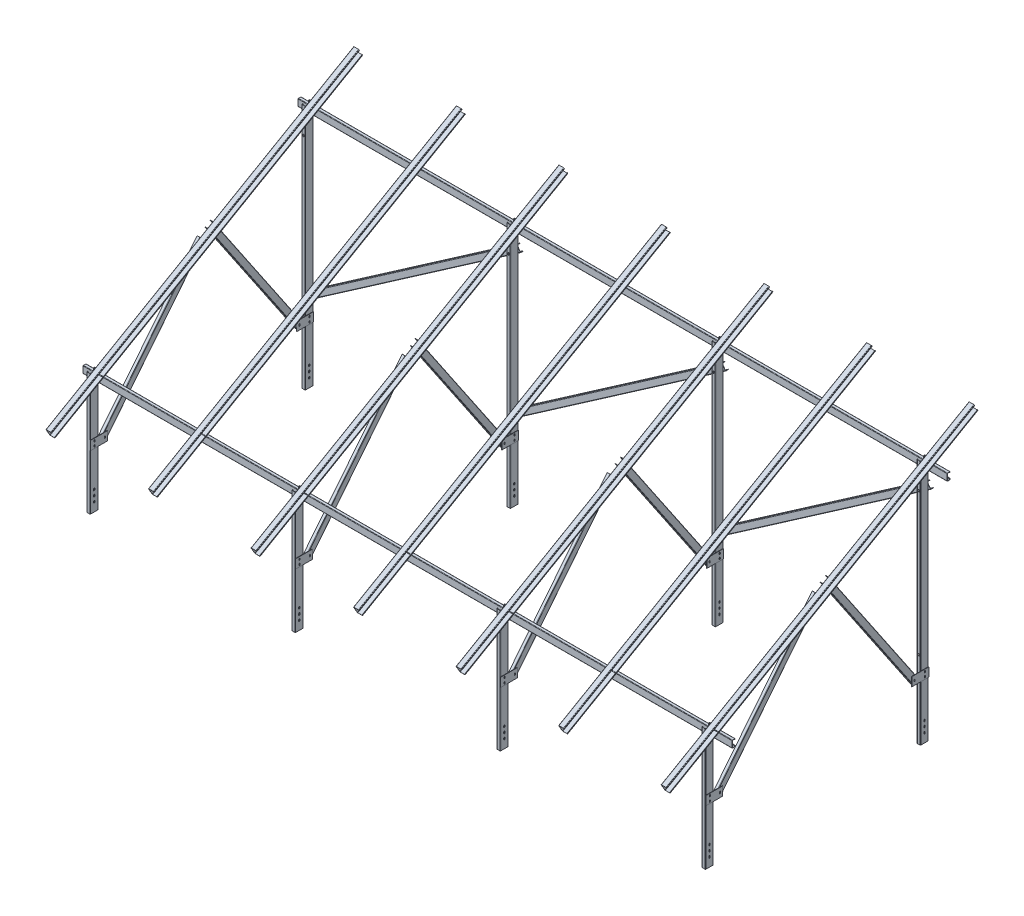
SolidWorks part; units mm, degrees
ref_plane "Front Plane" through (0, 0, 0) normal (0, 0, 1) x (1, 0, 0)
ref_plane "Top Plane" through (0, 0, 0) normal (0, 1, 0) x (1, 0, 0)
ref_plane "Right Plane" through (0, 0, 0) normal (1, 0, 0) x (0, 0, -1)
sketch "Sketch1" plane through (0, 0, 0) normal (1, 0, 0) x (0, 0, -1)
  line L0 (0, 0) -> (0, 2767.1877)
  line L1 (-2420, 0) -> (-2420, 1370)
  line L2 (665.1075, 3151.1877) -> (-2798.9941, 1151.1877)
  line L3 (665.1075, 3151.1877) -> (0, 2767.1877) construction
  line L4 (-2798.9941, 1151.1877) -> (-1286.0917, 1151.1877) construction
  dimension "D1" = 30
  dimension "D2" = 2420
  dimension "D3" = 1370
  dimension "D4" = 4000
  dimension "D5" = 768
  dimension "D6" = 2767.1877
other "C sections C90X40(1)"
ref_plane "Plane13" through (-20, 0, 0) normal (0, 1, 0) x (-1, 0, 0)
sketch "Sketch1130" plane through (-20, 0, 0) normal (0, 1, 0) x (-1, 0, 0)
  line L0 (18, 40) -> (18, 32)
  line L1 (-15, 45) -> (15, 45)
  line L2 (-20, 40) -> (-20, -40)
  line L3 (-15, -45) -> (15, -45)
  line L4 (20, 40) -> (20, 32)
  line L5 (-20, 45) -> (20, -45) construction
  line L6 (-20, -45) -> (20, 45) construction
  line L7 (-15, -43) -> (15, -43)
  line L8 (-18, 40) -> (-18, -40)
  line L9 (-15, 43) -> (15, 43)
  line L10 (18, -32) -> (20, -32)
  line L11 (0, 0) -> (13.4194, 0) construction
  line L12 (18, 32) -> (20, 32)
  line L13 (20, -32) -> (20, -40)
  line L14 (20, 40) -> (20, -40) construction
  line L15 (18, -32) -> (18, -40)
  line L16 (18, 40) -> (18, -40) construction
  line L17 (0, -45) -> (0, 45) construction
  line L18 (-20, 0) -> (20, 0) construction
  arc A0 (15, 45) -> (20, 40) centre (15, 40) cw
  arc A1 (-20, -40) -> (-15, -45) centre (-15, -40) ccw
  arc A2 (-15, 45) -> (-20, 40) centre (-15, 40) ccw
  arc A3 (15, -45) -> (20, -40) centre (15, -40) ccw
  arc A4 (15, -43) -> (18, -40) centre (15, -40) ccw
  arc A5 (-18, -40) -> (-15, -43) centre (-15, -40) ccw
  arc A6 (-15, 43) -> (-18, 40) centre (-15, 40) ccw
  arc A7 (15, 43) -> (18, 40) centre (15, 40) cw
  point P0 (0, 0)
  point P2 (0, 0)
  dimension "D1" = 5
  dimension "D2" = 40
  dimension "D3" = 90
  dimension "D5" = 13
  dimension "D4" = 2
sketch "Sketch16" plane through (0, 0, 0) normal (1, 0, 0) x (0, 0, -1)
  line L0 (0, 653.1877) -> (0, 641.1877) construction
  line L1 (7, 653.1877) -> (7, 641.1877)
  line L2 (-7, 653.1877) -> (-7, 641.1877)
  line L3 (-2420, 0) -> (-2420, 1500) construction
  line L8 (-2460, 1370) -> (-2380, 1370) construction
  line L9 (-2380, 0) -> (-2460, 0) construction
  line L10 (-2420, 639) -> (-2420, 651) construction
  line L11 (-2427, 639) -> (-2427, 651)
  line L12 (-2413, 639) -> (-2413, 651)
  line L13 (0, 703.1877) -> (0, 691.1877) construction
  line L14 (7, 703.1877) -> (7, 691.1877)
  line L15 (-7, 703.1877) -> (-7, 691.1877)
  line L16 (0, 653.1877) -> (0, 703.1877) construction
  line L17 (-2420, 689) -> (-2420, 701) construction
  line L18 (-2427, 689) -> (-2427, 701)
  line L19 (-2413, 689) -> (-2413, 701)
  line L20 (-2420, 639) -> (-2420, 689) construction
  line L21 (0, 2743.1877) -> (0, 2731.1877) construction
  line L22 (-40, 2767.1877) -> (40, 2767.1877) construction
  line L35 (7, 2743.1877) -> (7, 2731.1877)
  line L36 (-7, 2743.1877) -> (-7, 2731.1877)
  line L37 (0, 653.1877) -> (0, 2743.1877) construction
  line L48 (-2420, 1334) -> (-2420, 1346) construction
  line L49 (-2427, 1334) -> (-2427, 1346)
  line L50 (-2413, 1334) -> (-2413, 1346)
  line L51 (-2420, 639) -> (-2420, 1334) construction
  arc A0 (7, 653.1877) -> (-7, 653.1877) centre (0, 653.1877) ccw
  arc A1 (-7, 641.1877) -> (7, 641.1877) centre (0, 641.1877) ccw
  arc A6 (-2427, 639) -> (-2413, 639) centre (-2420, 639) ccw
  arc A7 (-2413, 651) -> (-2427, 651) centre (-2420, 651) ccw
  arc A8 (7, 703.1877) -> (-7, 703.1877) centre (0, 703.1877) ccw
  arc A9 (-7, 691.1877) -> (7, 691.1877) centre (0, 691.1877) ccw
  arc A10 (-2427, 689) -> (-2413, 689) centre (-2420, 689) ccw
  arc A11 (-2413, 701) -> (-2427, 701) centre (-2420, 701) ccw
  arc A18 (7, 2743.1877) -> (-7, 2743.1877) centre (0, 2743.1877) ccw
  arc A19 (-7, 2731.1877) -> (7, 2731.1877) centre (0, 2731.1877) ccw
  arc A28 (-2427, 1334) -> (-2413, 1334) centre (-2420, 1334) ccw
  arc A29 (-2413, 1346) -> (-2427, 1346) centre (-2420, 1346) ccw
  point P2 (0, 647.1877)
  point P16 (-2420, 645)
  point P24 (0, 697.1877)
  point P33 (-2420, 695)
  point P43 (0, 2737.1877)
  point P98 (-2420, 1340)
  dimension "D3" = 7
  dimension "D6" = 7
  dimension "D12" = 695
  dimension "D2" = 12
  dimension "D4" = 30
  dimension "D5" = 12
  dimension "D8" = 50
  dimension "D10" = 50
  dimension "D11" = 2
  dimension "D13" = 30
  dimension "D16" = 2090
  dimension "D14" = 1500
  dimension "D7" = 2
  dimension "D9" = 2
  dimension "D21" = 2
extrude "Cut-Extrude1" cut sketch "Sketch16" against normal blind 10
sketch "Sketch1115" plane through (0, 0, 0) normal (1, 0, 0) x (0, 0, -1)
  line L0 (-2420, 1327) -> (-2420, 1353) construction
  line L1 (0, 2724.1877) -> (0, 2750.1877) construction
  line L2 (522.0508, 3038.5938) -> (-2942.0508, 1038.5938)
  line L3 (-1210, 2038.5938) -> (-1210, 0) construction
  line L4 (-2420, 0) -> (0, 0) construction
  line L5 (-2460, 0) -> (-2380, 0) construction
  arc A0 (-2427, 1334) -> (-2413, 1334) centre (-2420, 1334) ccw construction
  arc A1 (-2413, 1346) -> (-2427, 1346) centre (-2420, 1346) ccw construction
  arc A2 (-7, 2731.1877) -> (7, 2731.1877) centre (0, 2731.1877) ccw construction
  arc A3 (7, 2743.1877) -> (-7, 2743.1877) centre (0, 2743.1877) ccw construction
  point P8 (-2420, 1340)
  point P17 (0, 2737.1877)
  dimension "D1" = 4000
other "C sections C90X60(1)"
ref_plane "Plane15" through (30, 3038.5938, -522.0508) normal (0, -0.5, 0.866) x (1, 0, 0)
sketch "Sketch1153" plane through (30, 3038.5938, -522.0508) normal (0, -0.5, 0.866) x (1, 0, 0)
  line L0 (28, 40) -> (28, 32)
  line L1 (-25, 45) -> (25, 45)
  line L2 (-30, 40) -> (-30, -40)
  line L3 (-25, -45) -> (25, -45)
  line L4 (30, 40) -> (30, 32)
  line L5 (-30, 45) -> (30, -45) construction
  line L6 (-30, -45) -> (30, 45) construction
  line L7 (-25, -43) -> (25, -43)
  line L8 (-28, 40) -> (-28, -40)
  line L9 (-25, 43) -> (25, 43)
  line L10 (28, -32) -> (30, -32)
  line L11 (0, 0) -> (13.4194, 0) construction
  line L12 (28, 32) -> (30, 32)
  line L13 (30, -32) -> (30, -40)
  line L14 (30, 40) -> (30, -40) construction
  line L15 (28, -32) -> (28, -40)
  line L16 (28, 40) -> (28, -40) construction
  line L17 (0, -45) -> (0, 45) construction
  line L18 (-30, 0) -> (30, 0) construction
  arc A0 (25, 45) -> (30, 40) centre (25, 40) cw
  arc A1 (-30, -40) -> (-25, -45) centre (-25, -40) ccw
  arc A2 (-25, 45) -> (-30, 40) centre (-25, 40) ccw
  arc A3 (25, -45) -> (30, -40) centre (25, -40) ccw
  arc A4 (25, -43) -> (28, -40) centre (25, -40) ccw
  arc A5 (-28, -40) -> (-25, -43) centre (-25, -40) ccw
  arc A6 (-25, 43) -> (-28, 40) centre (-25, 40) ccw
  arc A7 (25, 43) -> (28, 40) centre (25, 40) cw
  point P0 (0, 0)
  point P2 (0, 0)
  dimension "D1" = 5
  dimension "D2" = 60
  dimension "D3" = 90
  dimension "D5" = 13
  dimension "D4" = 2
sketch "Sketch1116" plane through (0, 0, 0) normal (-1, 0, 0) x (0, 0, 1)
  line L0 (-522.0508, 3038.5938) -> (2942.0508, 1038.5938) construction
  line L1 (-502.0508, 3073.2348) -> (-542.0508, 3003.9528) construction
  line L2 (2962.0508, 1073.2348) -> (2922.0508, 1003.9528) construction
  line L3 (2412.9093, 1344.0938) -> (2423.3016, 1338.0938) construction
  line L4 (2416.4093, 1350.156) -> (2426.8016, 1344.156)
  line L5 (2409.4093, 1338.0316) -> (2419.8016, 1332.0316)
  line L6 (-3.3016, 2739.0938) -> (7.0907, 2733.0938) construction
  line L7 (0.1984, 2745.156) -> (10.5907, 2739.156)
  line L8 (-6.8016, 2733.0316) -> (3.5907, 2727.0316)
  line L9 (1213.4641, 2036.5938) -> (1223.8564, 2030.5938) construction
  line L10 (1216.9641, 2042.656) -> (1227.3564, 2036.656)
  line L11 (1209.9641, 2030.5316) -> (1220.3564, 2024.5316)
  line L12 (1083.5603, 2111.5938) -> (1093.9526, 2105.5938) construction
  line L13 (1087.0603, 2117.656) -> (1097.4526, 2111.656)
  line L14 (1080.0603, 2105.5316) -> (1090.4526, 2099.5316)
  arc A0 (2416.4093, 1350.156) -> (2409.4093, 1338.0316) centre (2412.9093, 1344.0938) ccw
  arc A1 (2419.8016, 1332.0316) -> (2426.8016, 1344.156) centre (2423.3016, 1338.0938) ccw
  arc A2 (0.1984, 2745.156) -> (-6.8016, 2733.0316) centre (-3.3016, 2739.0938) ccw
  arc A3 (3.5907, 2727.0316) -> (10.5907, 2739.156) centre (7.0907, 2733.0938) ccw
  arc A4 (1216.9641, 2042.656) -> (1209.9641, 2030.5316) centre (1213.4641, 2036.5938) ccw
  arc A5 (1220.3564, 2024.5316) -> (1227.3564, 2036.656) centre (1223.8564, 2030.5938) ccw
  arc A6 (1087.0603, 2117.656) -> (1080.0603, 2105.5316) centre (1083.5603, 2111.5938) ccw
  arc A7 (1090.4526, 2099.5316) -> (1097.4526, 2111.656) centre (1093.9526, 2105.5938) ccw
  point P8 (2418.1054, 1341.0938)
  point P15 (1.8946, 2736.0938)
  point P23 (1218.6603, 2033.5938)
  point P29 (1088.7564, 2108.5938)
  dimension "D2" = 7
  dimension "D1" = 12
  dimension "D3" = 605
  dimension "D4" = 605
  dimension "D5" = 150
  dimension "D6" = 1860
extrude "Cut-Extrude29" cut sketch "Sketch1116" against normal through all both and the other way through all
sketch "Sketch185" plane through (0, 0, 0) normal (1, 0, 0) x (0, 0, -1)
  line L0 (-2420, 0) -> (-2420, 100) construction
  line L1 (-2460, 0) -> (-2380, 0) construction
  line L2 (-2420, 94) -> (-2420, 106) construction
  line L3 (-2427, 94) -> (-2427, 106)
  line L4 (-2413, 94) -> (-2413, 106)
  line L5 (0, 0) -> (-2420, 0) construction
  line L6 (-1210, 0) -> (-1210, 231.3325) construction
  line L10 (-2420, 154) -> (-2420, 166) construction
  line L11 (-2427, 154) -> (-2427, 166)
  line L12 (-2413, 154) -> (-2413, 166)
  line L13 (-2420, 214) -> (-2420, 226) construction
  line L14 (-2427, 214) -> (-2427, 226)
  line L15 (-2413, 214) -> (-2413, 226)
  line L16 (-2420, 94) -> (-2420, 154) construction
  line L17 (0, 94) -> (0, 106) construction
  line L18 (7, 94) -> (7, 106)
  line L19 (-7, 94) -> (-7, 106)
  line L20 (0, 154) -> (0, 166) construction
  line L21 (7, 154) -> (7, 166)
  line L22 (-7, 154) -> (-7, 166)
  line L23 (0, 214) -> (0, 226) construction
  line L24 (7, 214) -> (7, 226)
  line L25 (-7, 214) -> (-7, 226)
  arc A6 (-2427, 94) -> (-2413, 94) centre (-2420, 94) ccw
  arc A7 (-2413, 106) -> (-2427, 106) centre (-2420, 106) ccw
  arc A10 (-2427, 154) -> (-2413, 154) centre (-2420, 154) ccw
  arc A11 (-2413, 166) -> (-2427, 166) centre (-2420, 166) ccw
  arc A12 (-2427, 214) -> (-2413, 214) centre (-2420, 214) ccw
  arc A13 (-2413, 226) -> (-2427, 226) centre (-2420, 226) ccw
  arc A14 (7, 94) -> (-7, 94) centre (0, 94) cw
  arc A15 (-7, 106) -> (7, 106) centre (0, 106) cw
  arc A16 (7, 154) -> (-7, 154) centre (0, 154) cw
  arc A17 (-7, 166) -> (7, 166) centre (0, 166) cw
  arc A18 (7, 214) -> (-7, 214) centre (0, 214) cw
  arc A19 (-7, 226) -> (7, 226) centre (0, 226) cw
  point P6 (-2420, 100)
  point P26 (-2420, 160)
  point P33 (-2420, 220)
  point P40 (0, 100)
  point P47 (0, 160)
  point P54 (0, 220)
  dimension "D1" = 12
  dimension "D3" = 7
  dimension "D2" = 100
  dimension "D4" = 3
  dimension "D5" = 60
extrude "Cut-Extrude26" cut sketch "Sketch185" against normal through all
sketch "Sketch151" plane through (0, 0, 0) normal (1, 0, 0) x (0, 0, -1)
  line L1 (45, 722.1877) -> (-145, 722.1877)
  line L2 (45, 722.1877) -> (45, 622.1877)
  line L3 (45, 622.1877) -> (-145, 622.1877)
  line L4 (-145, 722.1877) -> (-145, 622.1877)
  line L6 (-502.5519, 672.1877) -> (45, 672.1877) construction
  line L7 (0, 691.1877) -> (0, 703.1877) construction
  line L8 (-6, 691.1877) -> (-6, 703.1877)
  line L9 (6, 691.1877) -> (6, 703.1877)
  line L10 (0, 653.1877) -> (0, 641.1877) construction
  line L11 (-6, 653.1877) -> (-6, 641.1877)
  line L12 (6, 653.1877) -> (6, 641.1877)
  line L13 (-115, 678.1877) -> (-115, 666.1877) construction
  line L14 (-109, 678.1877) -> (-109, 666.1877)
  line L15 (-121, 678.1877) -> (-121, 666.1877)
  line L16 (0, 0) -> (-2420, 0) construction
  line L18 (-1210, 0) -> (-1210, 356) construction
  line L19 (-2420, 691.1877) -> (-2420, 703.1877) construction
  line L20 (-2414, 691.1877) -> (-2414, 703.1877)
  line L21 (-2426, 691.1877) -> (-2426, 703.1877)
  line L22 (-2420, 653.1877) -> (-2420, 641.1877) construction
  line L23 (-2414, 653.1877) -> (-2414, 641.1877)
  line L24 (-2426, 653.1877) -> (-2426, 641.1877)
  line L25 (-2305, 678.1877) -> (-2305, 666.1877) construction
  line L26 (-2311, 678.1877) -> (-2311, 666.1877)
  line L27 (-2299, 678.1877) -> (-2299, 666.1877)
  line L28 (-1917.4481, 672.1877) -> (-2465, 672.1877) construction
  line L30 (-2275, 722.1877) -> (-2275, 622.1877)
  line L31 (-2465, 622.1877) -> (-2275, 622.1877)
  line L32 (-2465, 722.1877) -> (-2465, 622.1877)
  line L33 (-2465, 722.1877) -> (-2275, 722.1877)
  line L34 (-7, 647.1877) -> (7, 647.1877) construction
  line L35 (-7, 653.1877) -> (-7, 641.1877) construction
  line L36 (7, 641.1877) -> (7, 653.1877) construction
  arc A2 (-6, 691.1877) -> (6, 691.1877) centre (0, 691.1877) ccw
  arc A3 (6, 703.1877) -> (-6, 703.1877) centre (0, 703.1877) ccw
  arc A4 (-6, 653.1877) -> (6, 653.1877) centre (0, 653.1877) cw
  arc A5 (6, 641.1877) -> (-6, 641.1877) centre (0, 641.1877) cw
  arc A6 (-109, 678.1877) -> (-121, 678.1877) centre (-115, 678.1877) ccw
  arc A7 (-121, 666.1877) -> (-109, 666.1877) centre (-115, 666.1877) ccw
  arc A8 (-2414, 691.1877) -> (-2426, 691.1877) centre (-2420, 691.1877) cw
  arc A9 (-2426, 703.1877) -> (-2414, 703.1877) centre (-2420, 703.1877) cw
  arc A10 (-2414, 653.1877) -> (-2426, 653.1877) centre (-2420, 653.1877) ccw
  arc A11 (-2426, 641.1877) -> (-2414, 641.1877) centre (-2420, 641.1877) ccw
  arc A12 (-2311, 678.1877) -> (-2299, 678.1877) centre (-2305, 678.1877) cw
  arc A13 (-2299, 666.1877) -> (-2311, 666.1877) centre (-2305, 666.1877) cw
  point P18 (0, 697.1877)
  point P26 (0, 647.1877)
  point P33 (-115, 672.1877)
  point P46 (-2420, 697.1877)
  point P53 (-2420, 647.1877)
  point P60 (-2305, 672.1877)
  dimension "D3" = 6
  dimension "D1" = 190
  dimension "D2" = 100
  dimension "D4" = 12
  dimension "D5" = 25
  dimension "D6" = 30
  dimension "D7" = 6
  dimension "D8" = 12
  dimension "D9" = 25
  dimension "D10" = 45
extrude "Boss-Extrude1" add sketch "Sketch151" along normal blind 4 separate body
sketch "Sketch1117" plane through (0, 0, 0) normal (-1, 0, 0) x (0, 0, 1)
  line L0 (2305, 660.1877) -> (2305, 684.1877) construction
  line L1 (1207.4019, 2040.0938) -> (1229.9186, 2027.0938) construction
  line L2 (1199.9487, 2057.0433) -> (2323.7116, 648.7382)
  line L3 (115, 660.1877) -> (115, 684.1877) construction
  line L4 (1077.4981, 2115.0938) -> (1100.0148, 2102.0938) construction
  line L5 (1109.1562, 2138.6859) -> (98.1662, 647.3558)
  arc A0 (2299, 666.1877) -> (2311, 666.1877) centre (2305, 666.1877) ccw construction
  arc A1 (2311, 678.1877) -> (2299, 678.1877) centre (2305, 678.1877) ccw construction
  arc A2 (1216.9641, 2042.656) -> (1209.9641, 2030.5316) centre (1213.4641, 2036.5938) ccw construction
  arc A3 (1220.3564, 2024.5316) -> (1227.3564, 2036.656) centre (1223.8564, 2030.5938) ccw construction
  arc A4 (109, 666.1877) -> (121, 666.1877) centre (115, 666.1877) ccw construction
  arc A5 (121, 678.1877) -> (109, 678.1877) centre (115, 678.1877) ccw construction
  arc A6 (1087.0603, 2117.656) -> (1080.0603, 2105.5316) centre (1083.5603, 2111.5938) ccw construction
  arc A7 (1090.4526, 2099.5316) -> (1097.4526, 2111.656) centre (1093.9526, 2105.5938) ccw construction
  point P8 (2305, 672.1877)
  point P17 (1218.6603, 2033.5938)
  point P28 (115, 672.1877)
  point P37 (1088.7564, 2108.5938)
  dimension "D1" = 30
  dimension "D2" = 30
  dimension "D3" = 30
other "U sections U70X35X2(2)"
ref_plane "Plane16" through (-17.5, 2138.6859, 1109.1562) normal (0, -0.8277, -0.5611) x (0, -0.5611, 0.8277)
sketch "Sketch1114" plane through (-17.5, 2138.6859, 1109.1562) normal (0, -0.8277, -0.5611) x (0, -0.5611, 0.8277)
  line L0 (33, -12.5) -> (33, 17.5)
  line L1 (-30, -17.5) -> (30, -17.5)
  line L2 (-35, -12.5) -> (-35, 17.5)
  line L4 (35, -12.5) -> (35, 17.5)
  line L5 (-35, -17.5) -> (35, 17.5) construction
  line L6 (-35, 17.5) -> (35, -17.5) construction
  line L7 (-30, -15.5) -> (30, -15.5)
  line L8 (-33, -12.5) -> (-33, 17.5)
  line L9 (-35, 17.5) -> (-33, 17.5)
  line L10 (0, -17.5) -> (0, 17.5) construction
  line L11 (35, 17.5) -> (33, 17.5)
  line L12 (-35, 0) -> (35, 0) construction
  arc A0 (30, -17.5) -> (35, -12.5) centre (30, -12.5) ccw
  arc A1 (-30, -17.5) -> (-35, -12.5) centre (-30, -12.5) cw
  arc A2 (30, -15.5) -> (33, -12.5) centre (30, -12.5) ccw
  arc A3 (-30, -15.5) -> (-33, -12.5) centre (-30, -12.5) cw
  point P0 (0, 0)
  point P24 (0, 0)
  dimension "D3" = 5
  dimension "D1" = 70
  dimension "D2" = 35
  dimension "D4" = 2
sketch "Sketch1120" plane through (0, 0, 0) normal (1, 0, 0) x (0, 0, -1)
  line L0 (-98.1662, 647.3558) -> (-1109.1562, 2138.6859) construction
  line L1 (-122.9981, 630.5219) -> (-73.3343, 664.1896) construction
  line L2 (-1133.9881, 2121.852) -> (-1084.3243, 2155.5197) construction
  line L3 (-111.6332, 667.2213) -> (-118.3668, 677.154) construction
  line L4 (-117.4273, 663.2934) -> (-124.1609, 673.2261)
  line L5 (-105.8391, 671.1492) -> (-112.5727, 681.0819)
  line L6 (-603.6612, 1393.0208) -> (-203.6463, 1664.1955) construction
  line L7 (-1095.6891, 2118.8204) -> (-1088.9556, 2108.8876) construction
  line L8 (-1101.4832, 2114.8925) -> (-1094.7497, 2104.9597)
  line L9 (-1089.895, 2122.7483) -> (-1083.1615, 2112.8155)
  line L10 (-1199.9487, 2057.0433) -> (-2323.7116, 648.7382) construction
  line L11 (-1223.3981, 2075.7549) -> (-1176.4992, 2038.3317) construction
  line L12 (-2347.161, 667.4498) -> (-2300.2621, 630.0266) construction
  line L13 (-2301.2577, 676.8775) -> (-2308.7423, 667.4978) construction
  line L14 (-2295.7861, 672.5115) -> (-2303.2708, 663.1317)
  line L15 (-2306.7292, 681.2436) -> (-2314.2139, 671.8638)
  line L16 (-1761.8301, 1352.8907) -> (-2153.7879, 1665.6551) construction
  line L17 (-1222.4026, 2028.9039) -> (-1214.9179, 2038.2837) construction
  line L18 (-1216.931, 2024.5379) -> (-1209.4464, 2033.9177)
  line L19 (-1227.8741, 2033.27) -> (-1220.3895, 2042.6498)
  arc A0 (-117.4273, 663.2934) -> (-105.8391, 671.1492) centre (-111.6332, 667.2213) ccw
  arc A1 (-112.5727, 681.0819) -> (-124.1609, 673.2261) centre (-118.3668, 677.154) ccw
  arc A2 (-1101.4832, 2114.8925) -> (-1089.895, 2122.7483) centre (-1095.6891, 2118.8204) cw
  arc A3 (-1083.1615, 2112.8155) -> (-1094.7497, 2104.9597) centre (-1088.9556, 2108.8876) cw
  arc A4 (-2295.7861, 672.5115) -> (-2306.7292, 681.2436) centre (-2301.2577, 676.8775) ccw
  arc A5 (-2314.2139, 671.8638) -> (-2303.2708, 663.1317) centre (-2308.7423, 667.4978) ccw
  arc A6 (-1216.931, 2024.5379) -> (-1227.8741, 2033.27) centre (-1222.4026, 2028.9039) cw
  arc A7 (-1220.3895, 2042.6498) -> (-1209.4464, 2033.9177) centre (-1214.9179, 2038.2837) cw
  point P8 (-115, 672.1877)
  point P18 (-1092.3224, 2113.854)
  point P31 (-2305, 672.1877)
  point P40 (-1218.6603, 2033.5938)
  dimension "D2" = 7
  dimension "D5" = 7
  dimension "D1" = 12
  dimension "D3" = 30
  dimension "D4" = 12
  dimension "D6" = 30
extrude "Cut-Extrude32" cut sketch "Sketch1120" against normal through all both and the other way through all
sketch "Sketch1109" plane through (0, 0, 2465) normal (0, 0, 1) x (1, 0, 0)
  line L0 (-20, 1370) -> (-20, 1280) construction
  line L2 (-35, 1370) -> (-5, 1370) construction
  line L3 (-20, 1274) -> (-20, 1286) construction
  line L4 (-27, 1274) -> (-27, 1286)
  line L5 (-13, 1274) -> (-13, 1286)
  arc A0 (-27, 1274) -> (-13, 1274) centre (-20, 1274) ccw
  arc A1 (-13, 1286) -> (-27, 1286) centre (-20, 1286) ccw
  point P6 (-20, 1280)
  dimension "D2" = 7
  dimension "D1" = 12
  dimension "D3" = 90
extrude "Cut-Extrude27" cut sketch "Sketch1109" against normal through all both and the other way through all
sketch "Sketch1110" plane through (0, 0, -45) normal (0, 0, -1) x (-1, 0, 0)
  line L0 (20, 2767.1877) -> (20, 2672.1877) construction
  line L1 (5, 2767.1877) -> (35, 2767.1877) construction
  line L2 (20, 2666.1877) -> (20, 2678.1877) construction
  line L3 (13, 2666.1877) -> (13, 2678.1877)
  line L4 (27, 2666.1877) -> (27, 2678.1877)
  line L5 (20, 2672.1877) -> (20, 2472.1877) construction
  line L6 (20, 2466.1877) -> (20, 2478.1877) construction
  line L7 (13, 2466.1877) -> (13, 2478.1877)
  line L8 (27, 2466.1877) -> (27, 2478.1877)
  line L9 (20, 0) -> (20, 872.1877) construction
  line L10 (5, 0) -> (35, 0) construction
  line L11 (20, 878.1877) -> (20, 866.1877) construction
  line L12 (27, 878.1877) -> (27, 866.1877)
  line L13 (13, 878.1877) -> (13, 866.1877)
  arc A0 (13, 2666.1877) -> (27, 2666.1877) centre (20, 2666.1877) ccw
  arc A1 (27, 2678.1877) -> (13, 2678.1877) centre (20, 2678.1877) ccw
  arc A2 (13, 2466.1877) -> (27, 2466.1877) centre (20, 2466.1877) ccw
  arc A3 (27, 2478.1877) -> (13, 2478.1877) centre (20, 2478.1877) ccw
  arc A4 (27, 878.1877) -> (13, 878.1877) centre (20, 878.1877) ccw
  arc A5 (13, 866.1877) -> (27, 866.1877) centre (20, 866.1877) ccw
  point P6 (20, 2672.1877)
  point P14 (20, 2472.1877)
  point P25 (20, 872.1877)
  dimension "D3" = 7
  dimension "D1" = 95
  dimension "D2" = 12
  dimension "D4" = 200
  dimension "D5" = 1600
extrude "Cut-Extrude28" cut sketch "Sketch1110" against normal through all both and the other way through all
sketch "Sketch1135" plane through (0, 0, 0) normal (1, 0, 0) x (0, 0, -1)
  line L0 (-2460, 0) -> (-2380, 0) construction
  line L1 (-2420, 300) -> (-2420, -1500)
  line L2 (-2420, 0) -> (0, 0) construction
  line L3 (-1210, 0) -> (-1210, 213.9057) construction
  line L4 (0, 300) -> (0, -1500)
  point P0 (-2420, 0)
  dimension "D1" = 1500
  dimension "D2" = 300
other "C sections C100X60(52)"
ref_plane "Plane20" through (-28, 300, 2420) normal (0, -1, 0) x (-1, 0, 0)
sketch "Sketch1133" plane through (-28, 300, 2420) normal (0, -1, 0) x (-1, 0, 0)
  line L0 (28, 45) -> (28, 37)
  line L1 (-25, 50) -> (25, 50)
  line L2 (-30, 45) -> (-30, -45)
  line L3 (-25, -50) -> (25, -50)
  line L4 (30, 45) -> (30, 37)
  line L5 (-30, 50) -> (30, -50) construction
  line L6 (-30, -50) -> (30, 50) construction
  line L7 (-25, -48) -> (25, -48)
  line L8 (-28, 45) -> (-28, -45)
  line L9 (-25, 48) -> (25, 48)
  line L10 (28, -37) -> (30, -37)
  line L11 (0, 0) -> (13.4194, 0) construction
  line L12 (28, 37) -> (30, 37)
  line L13 (30, -37) -> (30, -45)
  line L14 (30, 45) -> (30, -45) construction
  line L15 (28, -37) -> (28, -45)
  line L16 (28, 45) -> (28, -45) construction
  line L17 (0, -50) -> (0, 50) construction
  line L18 (-30, 0) -> (30, 0) construction
  arc A0 (25, 50) -> (30, 45) centre (25, 45) cw
  arc A1 (-30, -45) -> (-25, -50) centre (-25, -45) ccw
  arc A2 (-25, 50) -> (-30, 45) centre (-25, 45) ccw
  arc A3 (25, -50) -> (30, -45) centre (25, -45) ccw
  arc A4 (25, -48) -> (28, -45) centre (25, -45) ccw
  arc A5 (-28, -45) -> (-25, -48) centre (-25, -45) ccw
  arc A6 (-25, 48) -> (-28, 45) centre (-25, 45) ccw
  arc A7 (25, 48) -> (28, 45) centre (25, 45) cw
  point P0 (0, 0)
  point P2 (-28, 0)
  point P41 (0, 0)
  dimension "D1" = 5
  dimension "D2" = 60
  dimension "D3" = 100
  dimension "D5" = 13
  dimension "D4" = 2
sketch "Sketch1136" plane through (2, 0, 0) normal (1, 0, 0) x (0, 0, -1)
  line L2 (-2427, 106) -> (-2427, 94)
  line L3 (-2413, 94) -> (-2413, 106)
  line L4 (-2427, 106) -> (-2427, 94)
  line L5 (-2413, 94) -> (-2413, 106)
  line L6 (-2427, 166) -> (-2427, 154)
  line L7 (-2413, 154) -> (-2413, 166)
  line L8 (-2427, 166) -> (-2427, 154)
  line L9 (-2413, 154) -> (-2413, 166)
  line L10 (7, 94) -> (7, 106)
  line L11 (-7, 106) -> (-7, 94)
  line L12 (7, 94) -> (7, 106)
  line L13 (-7, 106) -> (-7, 94)
  line L14 (-2427, 226) -> (-2427, 214)
  line L15 (-2413, 214) -> (-2413, 226)
  line L16 (-2427, 226) -> (-2427, 214)
  line L17 (-2413, 214) -> (-2413, 226)
  line L18 (7, 214) -> (7, 226)
  line L19 (-7, 226) -> (-7, 214)
  line L20 (7, 214) -> (7, 226)
  line L21 (-7, 226) -> (-7, 214)
  line L22 (7, 154) -> (7, 166)
  line L23 (-7, 166) -> (-7, 154)
  line L24 (7, 154) -> (7, 166)
  line L25 (-7, 166) -> (-7, 154)
  arc A2 (-2413, 106) -> (-2427, 106) centre (-2420, 106) ccw
  arc A3 (-2427, 94) -> (-2413, 94) centre (-2420, 94) ccw
  arc A4 (-2413, 106) -> (-2427, 106) centre (-2420, 106) ccw
  arc A5 (-2427, 94) -> (-2413, 94) centre (-2420, 94) ccw
  arc A6 (-2413, 166) -> (-2427, 166) centre (-2420, 166) ccw
  arc A7 (-2427, 154) -> (-2413, 154) centre (-2420, 154) ccw
  arc A8 (-2413, 166) -> (-2427, 166) centre (-2420, 166) ccw
  arc A9 (-2427, 154) -> (-2413, 154) centre (-2420, 154) ccw
  arc A10 (7, 106) -> (-7, 106) centre (0, 106) ccw
  arc A11 (-7, 94) -> (7, 94) centre (0, 94) ccw
  arc A12 (7, 106) -> (-7, 106) centre (0, 106) ccw
  arc A13 (-7, 94) -> (7, 94) centre (0, 94) ccw
  arc A14 (-2413, 226) -> (-2427, 226) centre (-2420, 226) ccw
  arc A15 (-2427, 214) -> (-2413, 214) centre (-2420, 214) ccw
  arc A16 (-2413, 226) -> (-2427, 226) centre (-2420, 226) ccw
  arc A17 (-2427, 214) -> (-2413, 214) centre (-2420, 214) ccw
  arc A18 (7, 226) -> (-7, 226) centre (0, 226) ccw
  arc A19 (-7, 214) -> (7, 214) centre (0, 214) ccw
  arc A20 (7, 226) -> (-7, 226) centre (0, 226) ccw
  arc A21 (-7, 214) -> (7, 214) centre (0, 214) ccw
  arc A22 (7, 166) -> (-7, 166) centre (0, 166) ccw
  arc A23 (-7, 154) -> (7, 154) centre (0, 154) ccw
  arc A24 (7, 166) -> (-7, 166) centre (0, 166) ccw
  arc A25 (-7, 154) -> (7, 154) centre (0, 154) ccw
  dimension "D1" = 0
  dimension "D2" = 0
  dimension "D3" = 0
  dimension "D4" = 0
  dimension "D5" = 0
  dimension "D6" = 0
extrude "Cut-Extrude36" cut sketch "Sketch1136" against normal through all both and the other way through all
sketch "Sketch1111" plane through (0, 0, 2375) normal (0, 0, 1) x (1, 0, 0)
  line L0 (-20, 1267) -> (-20, 1293) construction
  line L1 (-170, 1280) -> (3288, 1280)
  arc A0 (-27, 1274) -> (-13, 1274) centre (-20, 1274) ccw construction
  arc A1 (-13, 1286) -> (-27, 1286) centre (-20, 1286) ccw construction
  point P8 (-20, 1280)
  dimension "D1" = 3458
  dimension "D2" = 150
sketch "Sketch1112" plane through (0, 0, -45) normal (0, 0, -1) x (-1, 0, 0)
  line L0 (20, 2659.1877) -> (20, 2685.1877) construction
  line L1 (170, 2672.1877) -> (-3288, 2672.1877)
  line L2 (170, 1280) -> (-3288, 1280) construction
  arc A0 (13, 2666.1877) -> (27, 2666.1877) centre (20, 2666.1877) ccw construction
  arc A1 (27, 2678.1877) -> (13, 2678.1877) centre (20, 2678.1877) ccw construction
  point P8 (20, 2672.1877)
  dimension "D1" = 150
other "C sections C80X35(1)"
ref_plane "Plane14" through (-170, 1280, 2357.5) normal (1, 0, 0) x (0, -1, 0)
sketch "Sketch1149" plane through (-170, 1280, 2357.5) normal (1, 0, 0) x (0, -1, 0)
  line L0 (-35, 15.5) -> (-27, 15.5)
  line L1 (-35, 17.5) -> (-27, 17.5)
  line L2 (-40, 12.5) -> (-40, -12.5)
  line L3 (-35, -17.5) -> (35, -17.5)
  line L4 (40, 12.5) -> (40, -12.5)
  line L5 (-40, 17.5) -> (40, -17.5) construction
  line L6 (-40, -17.5) -> (40, 17.5) construction
  line L7 (38, 12.5) -> (38, -12.5)
  line L8 (-35, -15.5) -> (35, -15.5)
  line L9 (-38, 12.5) -> (-38, -12.5)
  line L10 (27, 17.5) -> (27, 15.5)
  line L11 (0, 17.5) -> (0, -17.5) construction
  line L12 (-40, 0) -> (40, 0) construction
  line L13 (-27, 17.5) -> (-27, 15.5)
  line L14 (27, 17.5) -> (35, 17.5)
  line L15 (-35, 17.5) -> (35, 17.5) construction
  line L16 (27, 15.5) -> (35, 15.5)
  line L17 (-35, 15.5) -> (35, 15.5) construction
  arc A0 (35, 17.5) -> (40, 12.5) centre (35, 12.5) cw
  arc A1 (-40, -12.5) -> (-35, -17.5) centre (-35, -12.5) ccw
  arc A2 (-35, 17.5) -> (-40, 12.5) centre (-35, 12.5) ccw
  arc A3 (35, -17.5) -> (40, -12.5) centre (35, -12.5) ccw
  arc A4 (35, 15.5) -> (38, 12.5) centre (35, 12.5) cw
  arc A5 (35, -15.5) -> (38, -12.5) centre (35, -12.5) ccw
  arc A6 (-38, -12.5) -> (-35, -15.5) centre (-35, -12.5) ccw
  arc A7 (-35, 15.5) -> (-38, 12.5) centre (-35, 12.5) ccw
  point P0 (0, 0)
  point P38 (0, 0)
  dimension "D3" = 5
  dimension "D1" = 80
  dimension "D2" = 35
  dimension "D5" = 11
  dimension "D4" = 2
sketch "Sketch1118" plane through (0, 0, 2375) normal (0, 0, -1) x (-1, 0, 0)
  line L0 (13, 1280) -> (27, 1280) construction
  line L1 (13, 1274) -> (13, 1286) construction
  line L2 (27, 1286) -> (27, 1274) construction
  line L3 (14, 1280) -> (26, 1280) construction
  line L4 (14, 1287) -> (26, 1287)
  line L5 (14, 1273) -> (26, 1273)
  arc A0 (14, 1287) -> (14, 1273) centre (14, 1280) ccw
  arc A1 (26, 1273) -> (26, 1287) centre (26, 1280) ccw
  point P8 (20, 1280)
  dimension "D2" = 7
  dimension "D1" = 12
extrude "Cut-Extrude30" cut sketch "Sketch1118" against normal through all both and the other way through all
sketch "Sketch1119" plane through (0, 0, -45) normal (0, 0, -1) x (-1, 0, 0)
  line L0 (13, 2672.1877) -> (27, 2672.1877) construction
  line L1 (13, 2666.1877) -> (13, 2678.1877) construction
  line L2 (27, 2678.1877) -> (27, 2666.1877) construction
  line L3 (14, 2672.1877) -> (26, 2672.1877) construction
  line L4 (14, 2679.1877) -> (26, 2679.1877)
  line L5 (14, 2665.1877) -> (26, 2665.1877)
  arc A0 (14, 2679.1877) -> (14, 2665.1877) centre (14, 2672.1877) ccw
  arc A1 (26, 2665.1877) -> (26, 2679.1877) centre (26, 2672.1877) ccw
  point P8 (20, 2672.1877)
  dimension "D2" = 7
  dimension "D1" = 12
extrude "Cut-Extrude31" cut sketch "Sketch1119" against normal through all both and the other way through all
sketch "Sketch1121" plane through (0, 0, -45) normal (0, 0, 1) x (1, 0, 0)
  line L0 (-170, 2672.1877) -> (3288, 2672.1877) construction
  line L1 (-170, 2707.1877) -> (-170, 2637.1877) construction
  line L2 (3288, 2707.1877) -> (3288, 2637.1877) construction
  line L3 (1559, 2672.1877) -> (1559, 3824.1359) construction
  line L4 (-146, 2672.1877) -> (-134, 2672.1877) construction
  line L5 (-146, 2679.1877) -> (-134, 2679.1877)
  line L6 (-146, 2665.1877) -> (-134, 2665.1877)
  line L7 (-86, 2672.1877) -> (-74, 2672.1877) construction
  line L8 (-86, 2679.1877) -> (-74, 2679.1877)
  line L9 (-86, 2665.1877) -> (-74, 2665.1877)
  line L10 (3204, 2672.1877) -> (3192, 2672.1877) construction
  line L11 (3204, 2679.1877) -> (3192, 2679.1877)
  line L12 (3204, 2665.1877) -> (3192, 2665.1877)
  line L13 (3264, 2672.1877) -> (3252, 2672.1877) construction
  line L14 (3264, 2679.1877) -> (3252, 2679.1877)
  line L15 (3264, 2665.1877) -> (3252, 2665.1877)
  arc A0 (-146, 2679.1877) -> (-146, 2665.1877) centre (-146, 2672.1877) ccw
  arc A1 (-134, 2665.1877) -> (-134, 2679.1877) centre (-134, 2672.1877) ccw
  arc A2 (-86, 2679.1877) -> (-86, 2665.1877) centre (-86, 2672.1877) ccw
  arc A3 (-74, 2665.1877) -> (-74, 2679.1877) centre (-74, 2672.1877) ccw
  arc A4 (3204, 2679.1877) -> (3204, 2665.1877) centre (3204, 2672.1877) cw
  arc A5 (3192, 2665.1877) -> (3192, 2679.1877) centre (3192, 2672.1877) cw
  arc A6 (3264, 2679.1877) -> (3264, 2665.1877) centre (3264, 2672.1877) cw
  arc A7 (3252, 2665.1877) -> (3252, 2679.1877) centre (3252, 2672.1877) cw
  point P10 (-140, 2672.1877)
  point P16 (-80, 2672.1877)
  point P24 (3198, 2672.1877)
  point P31 (3258, 2672.1877)
  dimension "D4" = 7
  dimension "D1" = 30
  dimension "D2" = 60
  dimension "D3" = 12
extrude "Cut-Extrude33" cut sketch "Sketch1121" against normal through all both and the other way through all
sketch "Sketch1122" plane through (0, 0, 2375) normal (0, 0, 1) x (1, 0, 0)
  line L0 (-170, 1280) -> (3288, 1280) construction
  line L1 (-170, 1315) -> (-170, 1245) construction
  line L2 (3288, 1315) -> (3288, 1245) construction
  line L3 (-146, 1280) -> (-134, 1280) construction
  line L4 (-146, 1287) -> (-134, 1287)
  line L5 (-146, 1273) -> (-134, 1273)
  line L6 (-86, 1280) -> (-74, 1280) construction
  line L7 (-86, 1287) -> (-74, 1287)
  line L8 (-86, 1273) -> (-74, 1273)
  line L9 (1559, 1280) -> (1559, 2393.9367) construction
  line L10 (3204, 1280) -> (3192, 1280) construction
  line L11 (3204, 1287) -> (3192, 1287)
  line L12 (3204, 1273) -> (3192, 1273)
  line L13 (3264, 1280) -> (3252, 1280) construction
  line L14 (3264, 1287) -> (3252, 1287)
  line L15 (3264, 1273) -> (3252, 1273)
  arc A0 (-146, 1287) -> (-146, 1273) centre (-146, 1280) ccw
  arc A1 (-134, 1273) -> (-134, 1287) centre (-134, 1280) ccw
  arc A2 (-86, 1287) -> (-86, 1273) centre (-86, 1280) ccw
  arc A3 (-74, 1273) -> (-74, 1287) centre (-74, 1280) ccw
  arc A4 (3204, 1287) -> (3204, 1273) centre (3204, 1280) cw
  arc A5 (3192, 1273) -> (3192, 1287) centre (3192, 1280) cw
  arc A6 (3264, 1287) -> (3264, 1273) centre (3264, 1280) cw
  arc A7 (3252, 1273) -> (3252, 1287) centre (3252, 1280) cw
  point P8 (-140, 1280)
  point P14 (-80, 1280)
  point P24 (3198, 1280)
  point P31 (3258, 1280)
  dimension "D4" = 7
  dimension "D1" = 30
  dimension "D2" = 60
  dimension "D3" = 12
extrude "Cut-Extrude34" cut sketch "Sketch1122" against normal through all both and the other way through all
sketch "Sketch1138" plane through (0, 2645.1877, 0) normal (0, 1, 0) x (1, 0, 0)
  line L0 (-170, 62.5) -> (-50, 62.5) construction
  line L1 (0, -2962.0508) -> (0, 502.0508) construction
  line L2 (-44, 62.5) -> (-56, 62.5) construction
  line L3 (-44, 55.5) -> (-56, 55.5)
  line L4 (-44, 69.5) -> (-56, 69.5)
  line L6 (-170, -2357.5) -> (-50, -2357.5) construction
  line L8 (-44, -2357.5) -> (-56, -2357.5) construction
  line L9 (-44, -2364.5) -> (-56, -2364.5)
  line L10 (-44, -2350.5) -> (-56, -2350.5)
  line L11 (1110, 62.5) -> (1098, 62.5) construction
  line L12 (1110, 55.5) -> (1098, 55.5)
  line L13 (1110, 69.5) -> (1098, 69.5)
  line L14 (1110, -2357.5) -> (1098, -2357.5) construction
  line L15 (1110, -2364.5) -> (1098, -2364.5)
  line L16 (1110, -2350.5) -> (1098, -2350.5)
  line L17 (2264, 62.5) -> (2252, 62.5) construction
  line L18 (2264, 55.5) -> (2252, 55.5)
  line L19 (2264, 69.5) -> (2252, 69.5)
  line L20 (2264, -2357.5) -> (2252, -2357.5) construction
  line L21 (2264, -2364.5) -> (2252, -2364.5)
  line L22 (2264, -2350.5) -> (2252, -2350.5)
  line L23 (-44, -2357.5) -> (1110, -2357.5) construction
  line L24 (-170, -2345) -> (-170, -2370) construction
  line L25 (-170, 75) -> (-170, 50) construction
  arc A0 (-44, 55.5) -> (-44, 69.5) centre (-44, 62.5) ccw
  arc A1 (-56, 69.5) -> (-56, 55.5) centre (-56, 62.5) ccw
  arc A2 (-44, -2364.5) -> (-44, -2350.5) centre (-44, -2357.5) ccw
  arc A3 (-56, -2350.5) -> (-56, -2364.5) centre (-56, -2357.5) ccw
  arc A4 (1110, 55.5) -> (1110, 69.5) centre (1110, 62.5) ccw
  arc A5 (1098, 69.5) -> (1098, 55.5) centre (1098, 62.5) ccw
  arc A6 (1110, -2364.5) -> (1110, -2350.5) centre (1110, -2357.5) ccw
  arc A7 (1098, -2350.5) -> (1098, -2364.5) centre (1098, -2357.5) ccw
  arc A8 (2264, 55.5) -> (2264, 69.5) centre (2264, 62.5) ccw
  arc A9 (2252, 69.5) -> (2252, 55.5) centre (2252, 62.5) ccw
  arc A10 (2264, -2364.5) -> (2264, -2350.5) centre (2264, -2357.5) ccw
  arc A11 (2252, -2350.5) -> (2252, -2364.5) centre (2252, -2357.5) ccw
  point P6 (-50, 62.5)
  point P19 (-50, -2357.5)
  point P27 (1104, 62.5)
  point P34 (1104, -2357.5)
  point P41 (2258, 62.5)
  point P48 (2258, -2357.5)
  dimension "D2" = 7
  dimension "D1" = 12
  dimension "D3" = 50
  dimension "D5" = 1154
  dimension "D4" = 3
extrude "Cut-Extrude38" cut sketch "Sketch1138" against normal through all both and the other way through all
sketch "Sketch1140" plane through (0, 0, 0) normal (-1, 0, 0) x (0, 0, 1)
  line L0 (-79, 2645.1877) -> (-79, 2782.7983) construction
  line L1 (-80, 2645.1877) -> (-78, 2645.1877) construction
  line L2 (-79, 2782.7983) -> (-522.0508, 3038.5938) construction
  line L3 (-502.0508, 3073.2348) -> (-542.0508, 3003.9528) construction
  line L5 (-73.8038, 2779.7983) -> (-84.1962, 2785.7983) construction
  line L6 (-77.3038, 2773.7361) -> (-87.6962, 2779.7361)
  line L7 (-70.3038, 2785.8605) -> (-80.6962, 2791.8605)
  line L8 (2341, 1253) -> (2341, 1385.6107) construction
  line L9 (2340, 1253) -> (2342, 1253) construction
  line L10 (2341, 1385.6107) -> (2942.0508, 1038.5938) construction
  line L11 (2962.0508, 1073.2348) -> (2922.0508, 1003.9528) construction
  line L13 (2335.8038, 1388.6107) -> (2346.1962, 1382.6107) construction
  line L14 (2339.3038, 1394.6728) -> (2349.6962, 1388.6728)
  line L15 (2332.3038, 1382.5485) -> (2342.6962, 1376.5485)
  line L16 (2962.0508, 1073.2348) -> (-502.0508, 3073.2348) construction
  line L17 (2922.0508, 1003.9528) -> (-542.0508, 3003.9528) construction
  arc A0 (-77.3038, 2773.7361) -> (-70.3038, 2785.8605) centre (-73.8038, 2779.7983) ccw
  arc A1 (-80.6962, 2791.8605) -> (-87.6962, 2779.7361) centre (-84.1962, 2785.7983) ccw
  arc A2 (2339.3038, 1394.6728) -> (2332.3038, 1382.5485) centre (2335.8038, 1388.6107) ccw
  arc A3 (2342.6962, 1376.5485) -> (2349.6962, 1388.6728) centre (2346.1962, 1382.6107) ccw
  point P11 (-79, 2782.7983)
  point P27 (2341, 1385.6107)
  dimension "D2" = 7
  dimension "D1" = 12
extrude "Cut-Extrude39" cut sketch "Sketch1140" against normal through all both and the other way through all
sketch "Sketch1156" plane through (0, -1014.2969, 1756.8138) normal (0, -0.5, 0.866) x (1, 0, 0)
  line L12 (55, 2415.474) -> (5, 2415.474)
  line L13 (0, 2410.474) -> (0, 2330.474)
  line L14 (5, 2325.474) -> (55, 2325.474)
  line L15 (60, 2330.474) -> (60, 2338.474)
  line L16 (60, 2338.474) -> (58, 2338.474)
  line L17 (58, 2338.474) -> (58, 2330.474)
  line L18 (55, 2327.474) -> (5, 2327.474)
  line L19 (2, 2330.474) -> (2, 2410.474)
  line L20 (5, 2413.474) -> (55, 2413.474)
  line L21 (58, 2410.474) -> (58, 2402.474)
  line L22 (58, 2402.474) -> (60, 2402.474)
  line L23 (60, 2402.474) -> (60, 2410.474)
  line L24 (55, 2415.474) -> (5, 2415.474)
  line L25 (0, 2410.474) -> (0, 2330.474)
  line L26 (5, 2325.474) -> (55, 2325.474)
  line L27 (60, 2330.474) -> (60, 2338.474)
  line L28 (60, 2338.474) -> (58, 2338.474)
  line L29 (58, 2338.474) -> (58, 2330.474)
  line L30 (55, 2327.474) -> (5, 2327.474)
  line L31 (2, 2330.474) -> (2, 2410.474)
  line L32 (5, 2413.474) -> (55, 2413.474)
  line L33 (58, 2410.474) -> (58, 2402.474)
  line L34 (58, 2402.474) -> (60, 2402.474)
  line L35 (60, 2402.474) -> (60, 2410.474)
  arc A8 (60, 2410.474) -> (55, 2415.474) centre (55, 2410.474) ccw
  arc A9 (5, 2415.474) -> (0, 2410.474) centre (5, 2410.474) ccw
  arc A10 (0, 2330.474) -> (5, 2325.474) centre (5, 2330.474) ccw
  arc A11 (55, 2325.474) -> (60, 2330.474) centre (55, 2330.474) ccw
  arc A12 (55, 2327.474) -> (58, 2330.474) centre (55, 2330.474) ccw
  arc A13 (2, 2330.474) -> (5, 2327.474) centre (5, 2330.474) ccw
  arc A14 (5, 2413.474) -> (2, 2410.474) centre (5, 2410.474) ccw
  arc A15 (58, 2410.474) -> (55, 2413.474) centre (55, 2410.474) ccw
  arc A16 (60, 2410.474) -> (55, 2415.474) centre (55, 2410.474) ccw
  arc A17 (5, 2415.474) -> (0, 2410.474) centre (5, 2410.474) ccw
  arc A18 (0, 2330.474) -> (5, 2325.474) centre (5, 2330.474) ccw
  arc A19 (55, 2325.474) -> (60, 2330.474) centre (55, 2330.474) ccw
  arc A20 (55, 2327.474) -> (58, 2330.474) centre (55, 2330.474) ccw
  arc A21 (2, 2330.474) -> (5, 2327.474) centre (5, 2330.474) ccw
  arc A22 (5, 2413.474) -> (2, 2410.474) centre (5, 2410.474) ccw
  arc A23 (58, 2410.474) -> (55, 2413.474) centre (55, 2410.474) ccw
  dimension "D1" = 0
extrude "Boss-Extrude4" add sketch "Sketch1156" against normal up to surface (4000 mm away)
pattern_linear "LPattern2" count 9 spacing 3462
pattern_linear "LPattern5" count 14 spacing 2308
pattern_linear "LPattern3" count 27 spacing 1154
sketch "Sketch1126" plane through (0, 0, -45) normal (0, 0, -1) x (-1, 0, 0)
  line L0 (20, 859.1877) -> (20, 885.1877) construction
  line L1 (-2288, 2485.1877) -> (-2288, 2459.1877) construction
  line L2 (-2312.655, 2489.2795) -> (44.655, 855.0958)
  arc A0 (13, 866.1877) -> (27, 866.1877) centre (20, 866.1877) ccw construction
  arc A1 (27, 878.1877) -> (13, 878.1877) centre (20, 878.1877) ccw construction
  arc A4 (-2295, 2466.1877) -> (-2281, 2466.1877) centre (-2288, 2466.1877) ccw construction
  arc A5 (-2281, 2478.1877) -> (-2295, 2478.1877) centre (-2288, 2478.1877) ccw construction
  point P8 (20, 872.1877)
  point P17 (-2288, 2472.1877)
  dimension "D1" = 30
  dimension "D2" = 30
other "U sections U70X35X2(3)"
ref_plane "Plane17" through (2312.655, 2489.2795, -62.5) normal (-0.8218, -0.5697, 0) x (-0.5697, 0.8218, 0)
sketch "Sketch1125" plane through (2312.655, 2489.2795, -62.5) normal (-0.8218, -0.5697, 0) x (-0.5697, 0.8218, 0)
  line L0 (33, -12.5) -> (33, 17.5)
  line L1 (-30, -17.5) -> (30, -17.5)
  line L2 (-35, -12.5) -> (-35, 17.5)
  line L4 (35, -12.5) -> (35, 17.5)
  line L5 (-35, -17.5) -> (35, 17.5) construction
  line L6 (-35, 17.5) -> (35, -17.5) construction
  line L7 (-30, -15.5) -> (30, -15.5)
  line L8 (-33, -12.5) -> (-33, 17.5)
  line L9 (-35, 17.5) -> (-33, 17.5)
  line L10 (0, -17.5) -> (0, 17.5) construction
  line L11 (35, 17.5) -> (33, 17.5)
  line L12 (-35, 0) -> (35, 0) construction
  arc A0 (30, -17.5) -> (35, -12.5) centre (30, -12.5) ccw
  arc A1 (-30, -17.5) -> (-35, -12.5) centre (-30, -12.5) cw
  arc A2 (30, -15.5) -> (33, -12.5) centre (30, -12.5) ccw
  arc A3 (-30, -15.5) -> (-33, -12.5) centre (-30, -12.5) cw
  point P0 (0, 0)
  point P24 (0, 0)
  dimension "D3" = 5
  dimension "D1" = 70
  dimension "D2" = 35
  dimension "D4" = 2
sketch "Sketch1127" plane through (0, 0, -47) normal (0, 0, -1) x (-1, 0, 0)
  line L0 (-2312.655, 2489.2795) -> (44.655, 855.0958) construction
  line L1 (-2295.5631, 2513.9345) -> (-2329.7468, 2464.6245) construction
  line L2 (61.7468, 879.7508) -> (27.5631, 830.4408) construction
  line L3 (15.069, 875.606) -> (24.931, 868.7693) construction
  line L4 (19.0571, 881.3589) -> (28.9191, 874.5221)
  line L5 (11.0809, 869.8532) -> (20.9429, 863.0164)
  line L6 (-1134, 1672.1877) -> (-3273.8064, -1414.4831) construction
  line L7 (-2283.069, 2468.7693) -> (-2292.931, 2475.606) construction
  line L8 (-2279.0809, 2474.5221) -> (-2288.9429, 2481.3589)
  line L9 (-2287.0571, 2463.0164) -> (-2296.9191, 2469.8532)
  arc A0 (19.0571, 881.3589) -> (11.0809, 869.8532) centre (15.069, 875.606) ccw
  arc A1 (20.9429, 863.0164) -> (28.9191, 874.5221) centre (24.931, 868.7693) ccw
  arc A2 (-2279.0809, 2474.5221) -> (-2287.0571, 2463.0164) centre (-2283.069, 2468.7693) cw
  arc A3 (-2296.9191, 2469.8532) -> (-2288.9429, 2481.3589) centre (-2292.931, 2475.606) cw
  point P8 (20, 872.1877)
  point P17 (-2288, 2472.1877)
  dimension "D2" = 7
  dimension "D1" = 12
  dimension "D3" = 30
extrude "Cut-Extrude35" cut sketch "Sketch1127" against normal through all both and the other way through all
pattern_linear "LPattern4" count 13 spacing 2308
ref_plane "Plane18" through (14982, 0, 0) normal (1, 0, 0) x (0, 0, -1)
sketch "Sketch1137" plane through (0, 1253, 0) normal (0, 1, 0) x (1, 0, 0)
  line L0 (30064, -2962.0508) -> (30064, 502.0508) construction
  line L1 (37975.5975, 1223.189) -> (30214, 1223.189)
  line L2 (37975.5975, 1223.189) -> (37975.5975, -3448.7406)
  line L3 (37975.5975, -3448.7406) -> (30214, -3448.7406)
  line L4 (30214, 1223.189) -> (30214, -3448.7406)
  dimension "D1" = 150
extrude "Cut-Extrude37" cut sketch "Sketch1137" along normal through all both and the other way through all
delete or keep bodies "Body-Delete/Keep 1" type delete bodies bodies 809 810
sketch "Sketch1154" plane through (-170, 0, 0) normal (-1, 0, 0) x (0, 0, 1)
  line L12 (-75, 2632.1877) -> (-50, 2632.1877)
  line L13 (-45, 2637.1877) -> (-45, 2707.1877)
  line L14 (-50, 2712.1877) -> (-75, 2712.1877)
  line L15 (-80, 2707.1877) -> (-80, 2699.1877)
  line L16 (-80, 2699.1877) -> (-78, 2699.1877)
  line L17 (-78, 2699.1877) -> (-78, 2707.1877)
  line L18 (-75, 2710.1877) -> (-50, 2710.1877)
  line L19 (-47, 2707.1877) -> (-47, 2637.1877)
  line L20 (-50, 2634.1877) -> (-75, 2634.1877)
  line L21 (-78, 2637.1877) -> (-78, 2645.1877)
  line L22 (-78, 2645.1877) -> (-80, 2645.1877)
  line L23 (-80, 2645.1877) -> (-80, 2637.1877)
  line L24 (-75, 2632.1877) -> (-50, 2632.1877)
  line L25 (-45, 2637.1877) -> (-45, 2707.1877)
  line L26 (-50, 2712.1877) -> (-75, 2712.1877)
  line L27 (-80, 2707.1877) -> (-80, 2699.1877)
  line L28 (-80, 2699.1877) -> (-78, 2699.1877)
  line L29 (-78, 2699.1877) -> (-78, 2707.1877)
  line L30 (-75, 2710.1877) -> (-50, 2710.1877)
  line L31 (-47, 2707.1877) -> (-47, 2637.1877)
  line L32 (-50, 2634.1877) -> (-75, 2634.1877)
  line L33 (-78, 2637.1877) -> (-78, 2645.1877)
  line L34 (-78, 2645.1877) -> (-80, 2645.1877)
  line L35 (-80, 2645.1877) -> (-80, 2637.1877)
  arc A8 (-80, 2637.1877) -> (-75, 2632.1877) centre (-75, 2637.1877) ccw
  arc A9 (-50, 2632.1877) -> (-45, 2637.1877) centre (-50, 2637.1877) ccw
  arc A10 (-45, 2707.1877) -> (-50, 2712.1877) centre (-50, 2707.1877) ccw
  arc A11 (-75, 2712.1877) -> (-80, 2707.1877) centre (-75, 2707.1877) ccw
  arc A12 (-75, 2710.1877) -> (-78, 2707.1877) centre (-75, 2707.1877) ccw
  arc A13 (-47, 2707.1877) -> (-50, 2710.1877) centre (-50, 2707.1877) ccw
  arc A14 (-50, 2634.1877) -> (-47, 2637.1877) centre (-50, 2637.1877) ccw
  arc A15 (-78, 2637.1877) -> (-75, 2634.1877) centre (-75, 2637.1877) ccw
  arc A16 (-80, 2637.1877) -> (-75, 2632.1877) centre (-75, 2637.1877) ccw
  arc A17 (-50, 2632.1877) -> (-45, 2637.1877) centre (-50, 2637.1877) ccw
  arc A18 (-45, 2707.1877) -> (-50, 2712.1877) centre (-50, 2707.1877) ccw
  arc A19 (-75, 2712.1877) -> (-80, 2707.1877) centre (-75, 2707.1877) ccw
  arc A20 (-75, 2710.1877) -> (-78, 2707.1877) centre (-75, 2707.1877) ccw
  arc A21 (-47, 2707.1877) -> (-50, 2710.1877) centre (-50, 2707.1877) ccw
  arc A22 (-50, 2634.1877) -> (-47, 2637.1877) centre (-50, 2637.1877) ccw
  arc A23 (-78, 2637.1877) -> (-75, 2634.1877) centre (-75, 2637.1877) ccw
  dimension "D1" = 0
extrude "Boss-Extrude2" add sketch "Sketch1154" against normal up to surface (30384 mm away)
sketch "Sketch1155" plane through (-170, 0, 0) normal (-1, 0, 0) x (0, 0, 1)
  line L12 (2345, 1240) -> (2370, 1240)
  line L13 (2375, 1245) -> (2375, 1315)
  line L14 (2370, 1320) -> (2345, 1320)
  line L15 (2340, 1315) -> (2340, 1307)
  line L16 (2340, 1307) -> (2342, 1307)
  line L17 (2342, 1307) -> (2342, 1315)
  line L18 (2345, 1318) -> (2370, 1318)
  line L19 (2373, 1315) -> (2373, 1245)
  line L20 (2370, 1242) -> (2345, 1242)
  line L21 (2342, 1245) -> (2342, 1253)
  line L22 (2342, 1253) -> (2340, 1253)
  line L23 (2340, 1253) -> (2340, 1245)
  line L24 (2345, 1240) -> (2370, 1240)
  line L25 (2375, 1245) -> (2375, 1315)
  line L26 (2370, 1320) -> (2345, 1320)
  line L27 (2340, 1315) -> (2340, 1307)
  line L28 (2340, 1307) -> (2342, 1307)
  line L29 (2342, 1307) -> (2342, 1315)
  line L30 (2345, 1318) -> (2370, 1318)
  line L31 (2373, 1315) -> (2373, 1245)
  line L32 (2370, 1242) -> (2345, 1242)
  line L33 (2342, 1245) -> (2342, 1253)
  line L34 (2342, 1253) -> (2340, 1253)
  line L35 (2340, 1253) -> (2340, 1245)
  arc A8 (2340, 1245) -> (2345, 1240) centre (2345, 1245) ccw
  arc A9 (2370, 1240) -> (2375, 1245) centre (2370, 1245) ccw
  arc A10 (2375, 1315) -> (2370, 1320) centre (2370, 1315) ccw
  arc A11 (2345, 1320) -> (2340, 1315) centre (2345, 1315) ccw
  arc A12 (2345, 1318) -> (2342, 1315) centre (2345, 1315) ccw
  arc A13 (2373, 1315) -> (2370, 1318) centre (2370, 1315) ccw
  arc A14 (2370, 1242) -> (2373, 1245) centre (2370, 1245) ccw
  arc A15 (2342, 1245) -> (2345, 1242) centre (2345, 1245) ccw
  arc A16 (2340, 1245) -> (2345, 1240) centre (2345, 1245) ccw
  arc A17 (2370, 1240) -> (2375, 1245) centre (2370, 1245) ccw
  arc A18 (2375, 1315) -> (2370, 1320) centre (2370, 1315) ccw
  arc A19 (2345, 1320) -> (2340, 1315) centre (2345, 1315) ccw
  arc A20 (2345, 1318) -> (2342, 1315) centre (2345, 1315) ccw
  arc A21 (2373, 1315) -> (2370, 1318) centre (2370, 1315) ccw
  arc A22 (2370, 1242) -> (2373, 1245) centre (2370, 1245) ccw
  arc A23 (2342, 1245) -> (2345, 1242) centre (2345, 1245) ccw
  dimension "D1" = 0
extrude "Boss-Extrude3" add sketch "Sketch1155" against normal up to surface (30384 mm away)
sketch "Sketch1157" plane through (0, 1320, 0) normal (0, 1, 0) x (1, 0, 0)
  line L1 (7134, 1179.5716) -> (30699.6409, 1179.5716)
  line L2 (7134, 1179.5716) -> (7134, -3665.4908)
  line L3 (7134, -3665.4908) -> (30699.6409, -3665.4908)
  line L4 (30699.6409, 1179.5716) -> (30699.6409, -3665.4908)
  line L6 (6984, -2962.0508) -> (6984, 502.0508) construction
  dimension "D1" = 150
extrude "Cut-Extrude40" cut sketch "Sketch1157" against normal through all both and the other way through all
delete or keep bodies "Body-Delete/Keep 4" type delete bodies bodies 985
